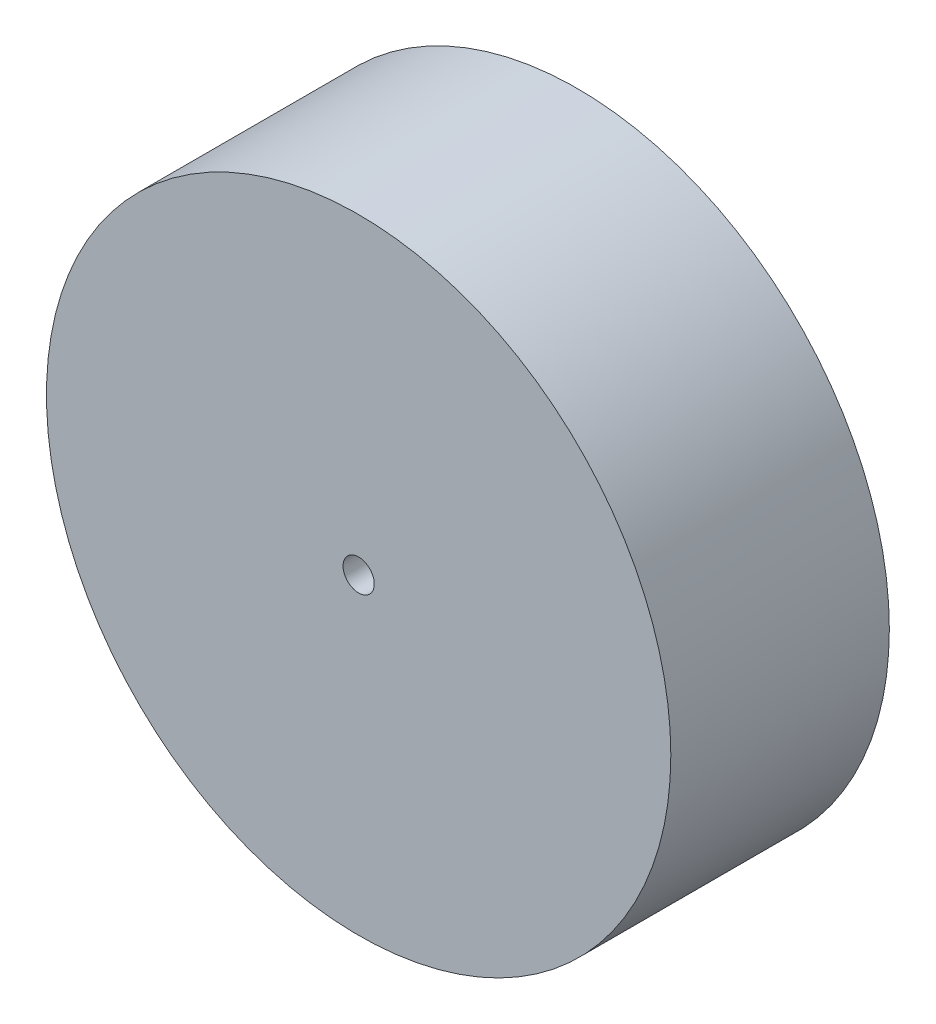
SolidWorks part; units mm, degrees
ref_plane "Front Plane" through (0, 0, 0) normal (0, 0, 1) x (1, 0, 0)
ref_plane "Top Plane" through (0, 0, 0) normal (0, 1, 0) x (1, 0, 0)
ref_plane "Right Plane" through (0, 0, 0) normal (1, 0, 0) x (0, 0, -1)
sketch "Sketch1" plane through (0, 0, 0) normal (0, 0, 1) x (1, 0, 0)
  circle A0 centre (0, 0) radius 10
extrude "Boss-Extrude1" add sketch "Sketch1" along normal blind 30
sketch "Sketch2" plane through (0, 0, 30) normal (0, 0, 1) x (1, 0, 0)
  circle A0 centre (0, 0) radius 100
extrude "Boss-Extrude2" add sketch "Sketch2" along normal blind 70
sketch "Sketch3" plane through (0, 0, 0) normal (0, 0, -1) x (-1, 0, 0)
  circle A0 centre (0, 0) radius 5
extrude "Cut-Extrude1" cut sketch "Sketch3" against normal blind 110
ref_point "Point1"
